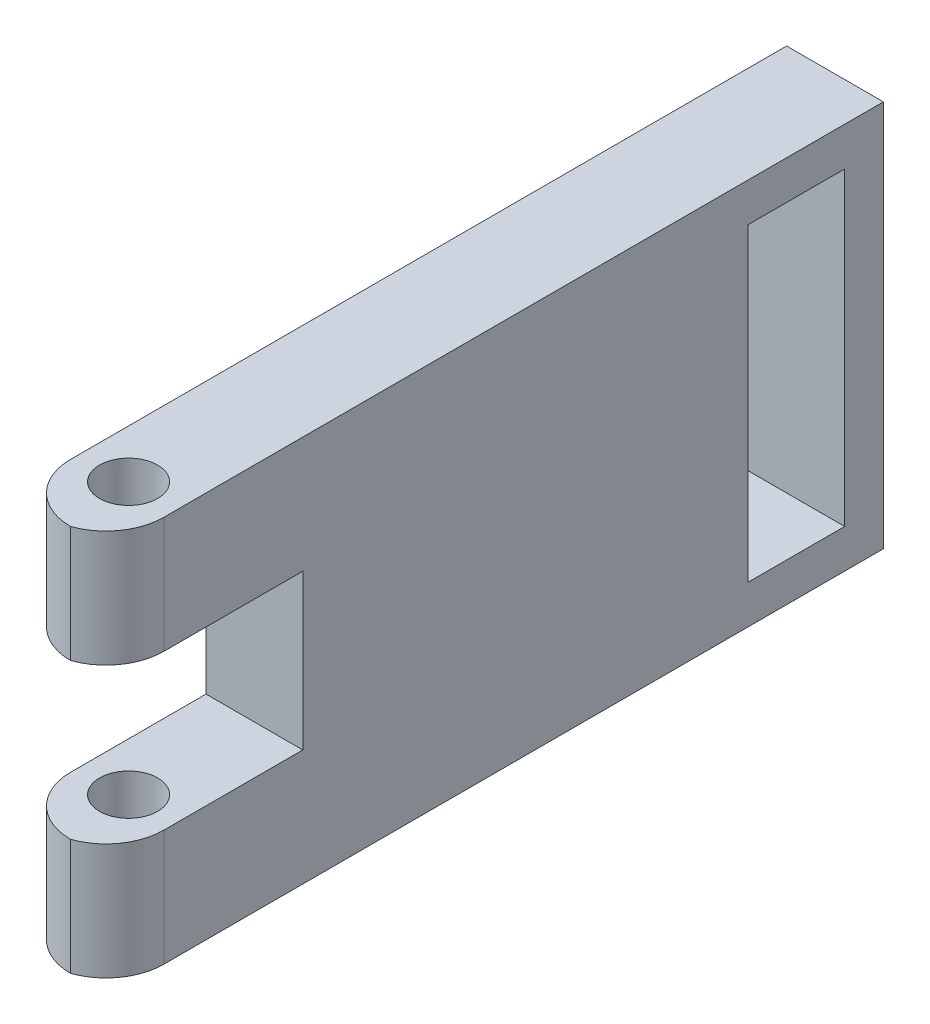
SolidWorks part; units mm, degrees
ref_plane "Front Plane" through (0, 0, 0) normal (0, 0, 1) x (1, 0, 0)
ref_plane "Top Plane" through (0, 0, 0) normal (0, 1, 0) x (1, 0, 0)
ref_plane "Right Plane" through (0, 0, 0) normal (1, 0, 0) x (0, 0, -1)
sketch "Sketch1" plane through (0, 0, 0) normal (1, 0, 0) x (0, 0, -1)
  line L1 (0, 0) -> (30, 0)
  line L2 (0, 0) -> (0, 20)
  line L3 (0, 20) -> (30, 20)
  line L4 (30, 0) -> (30, 20)
  dimension "D1" = 20
  dimension "D2" = 30
extrude "Boss-Extrude1" add sketch "Sketch1" along normal blind 5
sketch "Sketch3" plane through (0, 0, 0) normal (0, 0, 1) x (1, 0, 0)
  line L0 (5, 20) -> (5, 0) construction
  line L1 (0, 0) -> (5, 0)
  line L2 (0, 0) -> (0, 6)
  line L3 (0, 6) -> (5, 6)
  line L4 (5, 0) -> (5, 6)
  dimension "D1" = 6
extrude "Boss-Extrude2" add sketch "Sketch3" along normal blind 10
sketch "Sketch4" plane through (0, 0, 0) normal (0, 0, 1) x (1, 0, 0)
  line L0 (5, 20) -> (5, 6) construction
  line L1 (0, 20) -> (5, 20)
  line L2 (0, 20) -> (0, 14)
  line L3 (0, 14) -> (5, 14)
  line L4 (5, 20) -> (5, 14)
  dimension "D1" = 6
extrude "Boss-Extrude3" add sketch "Sketch4" along normal blind 10 contours L2 L1 L4 L3
fillet "Fillet7" radius 3 1 edges at (0, 3, 10)
fillet "Fillet8" radius 3 1 edges at (5, 3, 10)
fillet "Fillet9" radius 3 1 edges at (0, 17, 10)
fillet "Fillet10" radius 3 1 edges at (5, 17, 10)
sketch "Sketch5" plane through (0, 20, 0) normal (0, 1, 0) x (1, 0, 0)
  line L0 (5, 30) -> (5, -7.1716) construction
  circle A0 centre (2.5, -6.5) radius 1.5
  dimension "D1" = 3
  dimension "D2" = 2.5
  dimension "5" = 6.5
extrude "Cut-Extrude1" cut sketch "Sketch5" against normal through all both and the other way through all contours A0
sketch "Sketch8" plane through (5, 0, 0) normal (1, 0, 0) x (0, 0, -1)
  line L0 (30, 20) -> (-7.1716, 20) construction
  line L1 (23, 18) -> (28, 18)
  line L2 (23, 18) -> (23, 2)
  line L3 (23, 2) -> (28, 2)
  line L4 (28, 18) -> (28, 2)
  line L5 (-7.1716, 0) -> (30, 0) construction
  line L6 (30, 0) -> (30, 20) construction
  dimension "D1" = 5
  dimension "D2" = 2
  dimension "D3" = 2
  dimension "D4" = 2
extrude "Cut-Extrude3" cut sketch "Sketch8" against normal through all both and the other way through all contours L2 L1 L4 L3
